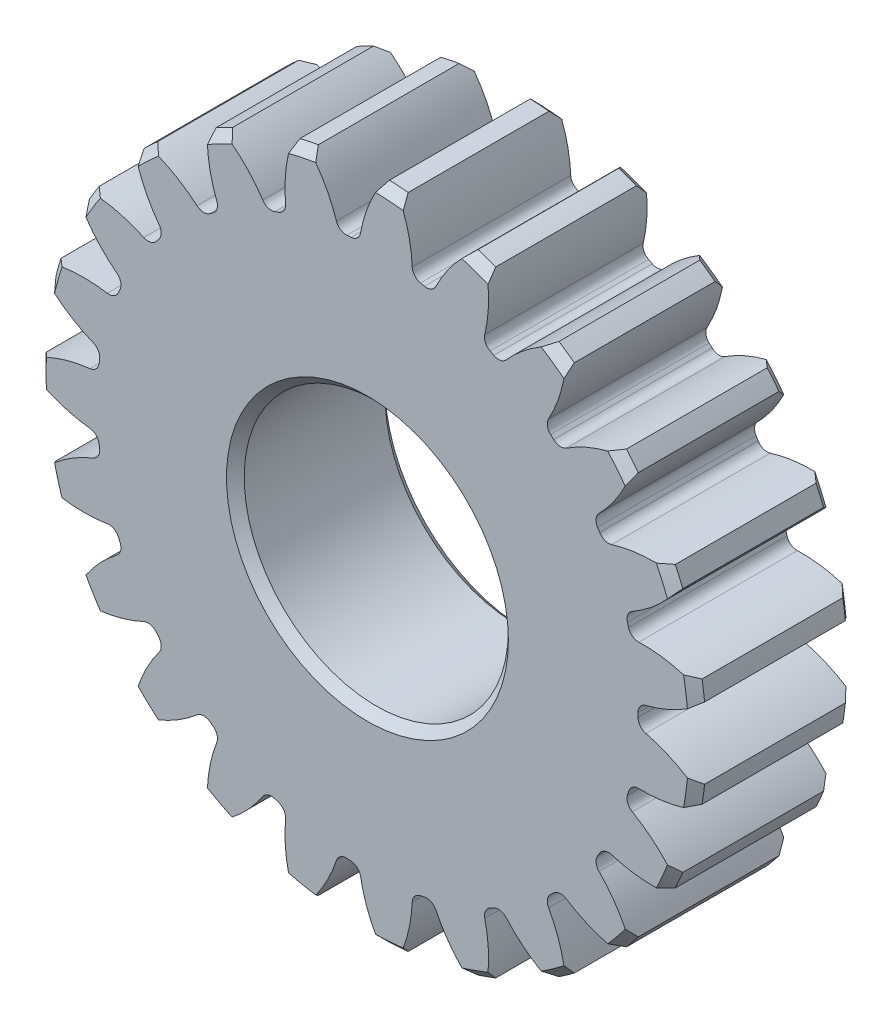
SolidWorks part; units mm, degrees
ref_plane "Front Plane" through (0, 0, 0) normal (0, 0, 1) x (1, 0, 0)
ref_plane "Top Plane" through (0, 0, 0) normal (0, 1, 0) x (1, 0, 0)
ref_plane "Right Plane" through (0, 0, 0) normal (1, 0, 0) x (0, 0, -1)
sketch "Sketch1" plane through (0, 0, 0) normal (0, 0, 1) x (1, 0, 0)
  line L0 (0, 0) -> (0, 2.3) construction
  line L1 (-0.7392, 2.569) -> (0.7392, 2.031) construction
  circle A0 centre (0, 0) radius 2.05 construction
  circle A1 centre (0, 0) radius 2.5 construction
  circle A2 centre (0, 0) radius 2.3 construction
  circle A3 centre (0, 0) radius 2.1613 construction
  circle A5 centre (0, 0) radius 1 construction
  point P8 (0.1, 0)
  point P13 (11.5, 0)
sketch "Sketch2" plane through (0, 0, 0) normal (1, 0, 0) x (0, 0, -1)
  line L0 (-0.6, 0) -> (0.6, 0) construction
  line L1 (0.6, 2.5) -> (0.6, -2.5) construction
  line L3 (-0.6, 2.5) -> (0.6, 2.5) construction
  line L5 (-0.6, 12.5) -> (-0.6, -12.5) construction
  point P2 (0, 2.5)
  dimension "Overall Width" = 1.2
  dimension "Face Width" = 0.6
sketch "Sketch3" plane through (0, 0, 0) normal (0, 0, 1) x (1, 0, 0)
  circle A0 centre (0, 0) radius 2.5
  circle A1 centre (0, 0) radius 2.5 construction
extrude "Boss-Extrude1" add sketch "Sketch3" against normal up to vertex (0.6 mm away) and the other way up to vertex (0.6 mm away)
sketch "Sketch5" plane through (0, 0, 0) normal (1, 0, 0) x (0, 0, -1)
  line L5 (-0.6, 0) -> (0.6, 0)
  line L6 (-0.6, 0) -> (-0.6, 1)
  line L7 (-0.6, 1) -> (0.6, 1)
  line L8 (0.6, 0) -> (0.6, 1)
  point P12 (0, 1)
revolve "Cut-Revolve1" cut sketch "Sketch5" angle 360 about L0
chamfer "Chamfer2" distance 0.0671 angle 45 4 edges at (2.5, 0, -0.6) (1, 0, -0.6) (1, 0, 0.6) (2.5, 0, 0.6)
sketch "Sketch4" plane through (0, 0, 0) normal (0, 0, 1) x (1, 0, 0)
  line L0 (2.0485, -0.0785) -> (2.0485, 0.0785)
  arc A3 (2.4854, 0.2699) -> (2.4854, -0.2699) centre (0, 0) cw
  circle A4 centre (0, 0) radius 2.5 construction
  arc A5 (2.4854, 0.2699) -> (2.0485, 0.0785) centre (1.8432, 1.1419) cw
  circle A6 centre (0, 0) radius 2.05 construction
  arc A7 (2.4854, -0.2699) -> (2.0485, -0.0785) centre (1.8432, -1.1419) ccw
  spline S0 degree 4 poles (2.1582, 0.1153) (2.1588, 0.1154) (2.1603, 0.1155) (2.1631, 0.1158) (2.1678, 0.1164) (2.1737, 0.1174) (2.1813, 0.1188) (2.1902, 0.1207) (2.2, 0.1231) (2.2106, 0.126) (2.2211, 0.1291) (2.2316, 0.1324) (2.242, 0.136) (2.2546, 0.1405) (2.2696, 0.1463) (2.287, 0.1535) (2.3067, 0.1623) (2.3266, 0.1718) (2.346, 0.1818) (2.3656, 0.1923) (2.3844, 0.203) (2.4037, 0.2147) (2.4216, 0.2258) (2.4412, 0.2388) (2.4573, 0.2496) (2.4822, 0.2674) (2.4928, 0.2753) (2.5088, 0.2874) (2.5141, 0.2916) knots 0 0 0 0 0 0.005377 0.015084 0.028532 0.04661 0.064855 0.092111 0.119476 0.146842 0.174209 0.201575 0.228941 0.256307 0.307035 0.361767 0.4165 0.471232 0.525964 0.580697 0.635429 0.690161 0.744894 0.799626 0.854358 0.909091 1 1 1 1 1 construction
  spline S1 degree 4 poles (2.1582, 0.1153) (2.1588, 0.1154) (2.1603, 0.1155) (2.1631, 0.1158) (2.1678, 0.1164) (2.1737, 0.1174) (2.1813, 0.1188) (2.1902, 0.1207) (2.2, 0.1231) (2.2106, 0.126) (2.2211, 0.1291) (2.2316, 0.1324) (2.242, 0.136) (2.2546, 0.1405) (2.2696, 0.1463) (2.287, 0.1535) (2.3067, 0.1623) (2.3266, 0.1718) (2.346, 0.1818) (2.3656, 0.1923) (2.3844, 0.203) (2.4037, 0.2147) (2.4216, 0.2258) (2.4412, 0.2388) (2.4573, 0.2496) (2.4734, 0.2611) (2.4814, 0.2669) (2.4854, 0.2699) knots 0 0 0 0 0 0.005377 0.015084 0.028532 0.04661 0.064855 0.092111 0.119476 0.146842 0.174209 0.201575 0.228941 0.256307 0.307035 0.361767 0.4165 0.471232 0.525964 0.580697 0.635429 0.690161 0.744894 0.799626 0.854358 0.909091 0.909091 0.909091 0.909091 0.909091 construction
  spline S2 degree 4 poles (2.1582, -0.1153) (2.1588, -0.1154) (2.1603, -0.1155) (2.1631, -0.1158) (2.1678, -0.1164) (2.1737, -0.1174) (2.1813, -0.1188) (2.1902, -0.1207) (2.2, -0.1231) (2.2106, -0.126) (2.2211, -0.1291) (2.2316, -0.1324) (2.242, -0.136) (2.2546, -0.1405) (2.2696, -0.1463) (2.287, -0.1535) (2.3067, -0.1623) (2.3266, -0.1718) (2.346, -0.1818) (2.3656, -0.1923) (2.3844, -0.203) (2.4037, -0.2147) (2.4216, -0.2258) (2.4412, -0.2388) (2.4573, -0.2496) (2.4822, -0.2674) (2.4928, -0.2753) (2.5088, -0.2874) (2.5141, -0.2916) knots 0 0 0 0 0 0.005377 0.015084 0.028532 0.04661 0.064855 0.092111 0.119476 0.146842 0.174209 0.201575 0.228941 0.256307 0.307035 0.361767 0.4165 0.471232 0.525964 0.580697 0.635429 0.690161 0.744894 0.799626 0.854358 0.909091 1 1 1 1 1 construction
  spline S3 degree 4 poles (2.1582, -0.1153) (2.1588, -0.1154) (2.1603, -0.1155) (2.1631, -0.1158) (2.1678, -0.1164) (2.1737, -0.1174) (2.1813, -0.1188) (2.1902, -0.1207) (2.2, -0.1231) (2.2106, -0.126) (2.2211, -0.1291) (2.2316, -0.1324) (2.242, -0.136) (2.2546, -0.1405) (2.2696, -0.1463) (2.287, -0.1535) (2.3067, -0.1623) (2.3266, -0.1718) (2.346, -0.1818) (2.3656, -0.1923) (2.3844, -0.203) (2.4037, -0.2147) (2.4216, -0.2258) (2.4412, -0.2388) (2.4573, -0.2496) (2.4734, -0.2611) (2.4814, -0.2669) (2.4854, -0.2699) knots 0 0 0 0 0 0.005377 0.015084 0.028532 0.04661 0.064855 0.092111 0.119476 0.146842 0.174209 0.201575 0.228941 0.256307 0.307035 0.361767 0.4165 0.471232 0.525964 0.580697 0.635429 0.690161 0.744894 0.799626 0.854358 0.909091 0.909091 0.909091 0.909091 0.909091 construction
extrude "Cut-Extrude1" cut sketch "Sketch4" against normal through all both and the other way through all
fillet "Fillet1" radius 0.0785 2 edges at (2.0485, -0.0785, 0) (2.0485, 0.0785, 0)
pattern_circular "CirPattern1" count 23 over 360 about axis through (0, 0, 0) along (0, 0, 1) of "Cut-Extrude1", "Fillet1"
equation "\"Number of Teeth\"= 23"
equation "\"Module\"= 0.2"
equation "\"Diametral Pitch\"= 1 / \"Module\""
equation "\"Dedendum\"= 1.25 / \"Diametral Pitch\""
equation "\"Pitch Diameter\"= \"Module\" * \"Number of Teeth\""
equation "\"Root Diameter\"= \"Pitch Diameter\" - ( 2 * \"Dedendum\" )"
equation "\"Root Diameter@Sketch1\"=\"Root Diameter\""
equation "\"OD@Sketch1\" = \"Outside Diameter\""
equation "\"D1@CirPattern1\"=\"Number of Teeth\""
equation "\"Pressure Angle\"= 20"
equation "\"Base Diameter\"= \"Pitch Diameter\" * cos ( \"Pressure Angle\" )"
equation "\"Outside Diameter\"= ( \"Number of Teeth\" + 2 ) / \"Diametral Pitch\""
equation "\"Pitch Angle\"= 360deg / \"Number of Teeth\""
equation "\"Alpha\"= sqr ( \"Pitch Diameter\" ^ 2 - \"Base Diameter\" ^ 2 ) / \"Base Diameter\" * 180 / PI - \"Pressure Angle\""
equation "\"Beta\"= ( \"Pitch Angle\" / 4 - \"Alpha\" )"
equation "\"Phi\"= sqr ( ( \"Outside Diameter\" / 2 ) ^ 2 - ( \"Base Diameter\" / 2 ) ^ 2 ) / ( \"Base Diameter\" / 2 )"
equation "\"Addendum\"= 1 / \"Diametral Pitch\""
equation "\"WorkingDepth\"= 2 / \"Diametral Pitch\""
equation "\"WholeDepth\"= 2.25 / \"Diametral Pitch\""
equation "\"Clearance\"= 0.25 / \"Diametral Pitch\""
equation "\"ToothThickness\"= ( pi * 2 ) / \"Diametral Pitch\""
equation "\"CircularPitch\"= pi / \"Diametral Pitch\""
equation "\"Number of Teeth@Sketch1\"=\"Number of Teeth\""
equation "\"Module@Sketch1\"=\"Module\""
equation "\"Pressure Angle@Sketch1\"=\"Pressure Angle\""
equation "\"Gear Pitch Diameter@Sketch1\"=\"Pitch Diameter\""
equation "\"Base Diameter@Sketch1\"=\"Base Diameter\""
equation "\"Fillet\"= \"Clearance\" * cos ( \"Pressure Angle\" ) * tan ( ( 90 + \"Pressure Angle\" ) / 2 )"
equation "\"D1\"= \"Fillet\""
equation "\"D1\"= \"Set Screw Pitch@Sketch1\" * .75"
equation "\"D1\"= \"Set Screw Diameter@Sketch1\" / 2"
equation "\"D3\"= \"Set Screw Pitch@Sketch1\" +  ( \"Hub Diameter@Sketch1\" / 2 ) "
equation "\"D4\"= \"Set Screw Pitch@Sketch1\""
equation "\"D2\"= \"Fillet\" * 2"
equation "\"D1\"= \"Fillet\" * 2"
equation "\"D1@Chamfer2\"=\"Fillet\""
equation "\"D1@Sketch4\"=\"CircularPitch\"*0.25"
equation "\"D1@Fillet1\"=\"CircularPitch\"*0.125"
